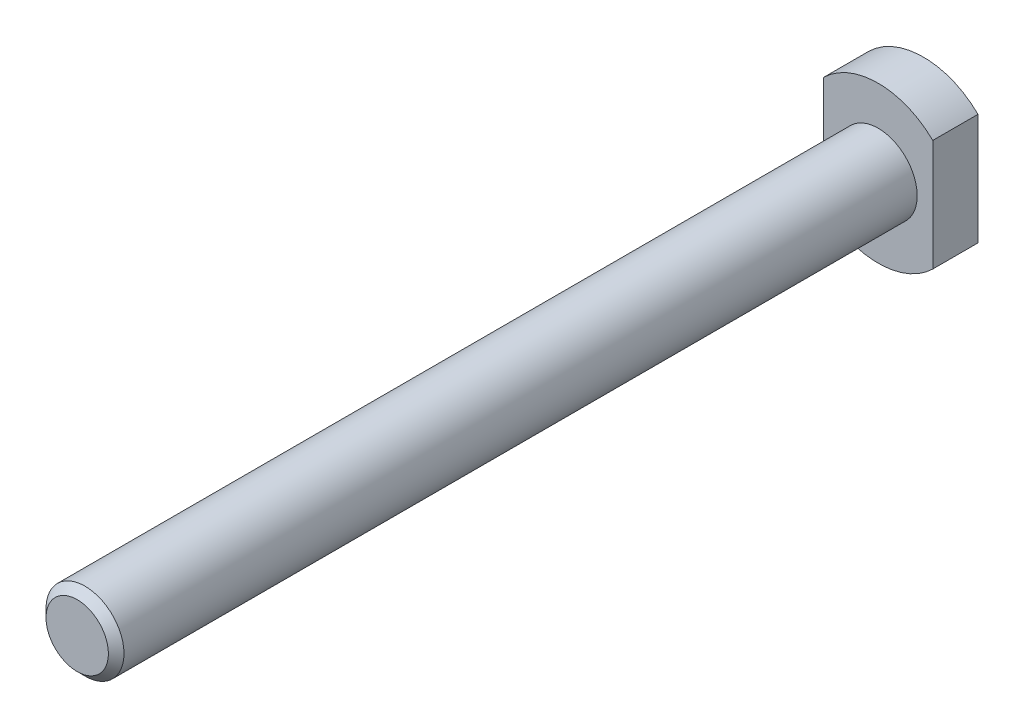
SolidWorks part; units mm, degrees
ref_plane "Front Plane" through (0, 0, 0) normal (0, 0, 1) x (1, 0, 0)
ref_plane "Top Plane" through (0, 0, 0) normal (0, 1, 0) x (1, 0, 0)
ref_plane "Right Plane" through (0, 0, 0) normal (1, 0, 0) x (0, 0, -1)
sketch "Sketch1" plane through (0, 0, 0) normal (0, 0, 1) x (1, 0, 0)
  line L0 (-7, 7.1414) -> (-7, -7.1414)
  line L1 (7, 7.1414) -> (7, -7.1414)
  line L2 (-7, 0) -> (7, 0) construction
  arc A0 (-7, -7.1414) -> (7, -7.1414) centre (0, 0) ccw
  arc A1 (7, 7.1414) -> (-7, 7.1414) centre (0, 0) ccw
  point P9 (0, 0)
  dimension "D1" = 20
  dimension "D2" = 14
extrude "Boss-Extrude1" add sketch "Sketch1" along normal blind 5.8
sketch "Sketch2" plane through (0, 0, 5.8) normal (0, 0, 1) x (1, 0, 0)
  circle A0 centre (0, 0) radius 5
  dimension "D1" = 10
extrude "Boss-Extrude2" add sketch "Sketch2" along normal blind 102.7
chamfer "Chamfer1" distance 1 angle 45 1 edges at (5, 0, 108.5)
